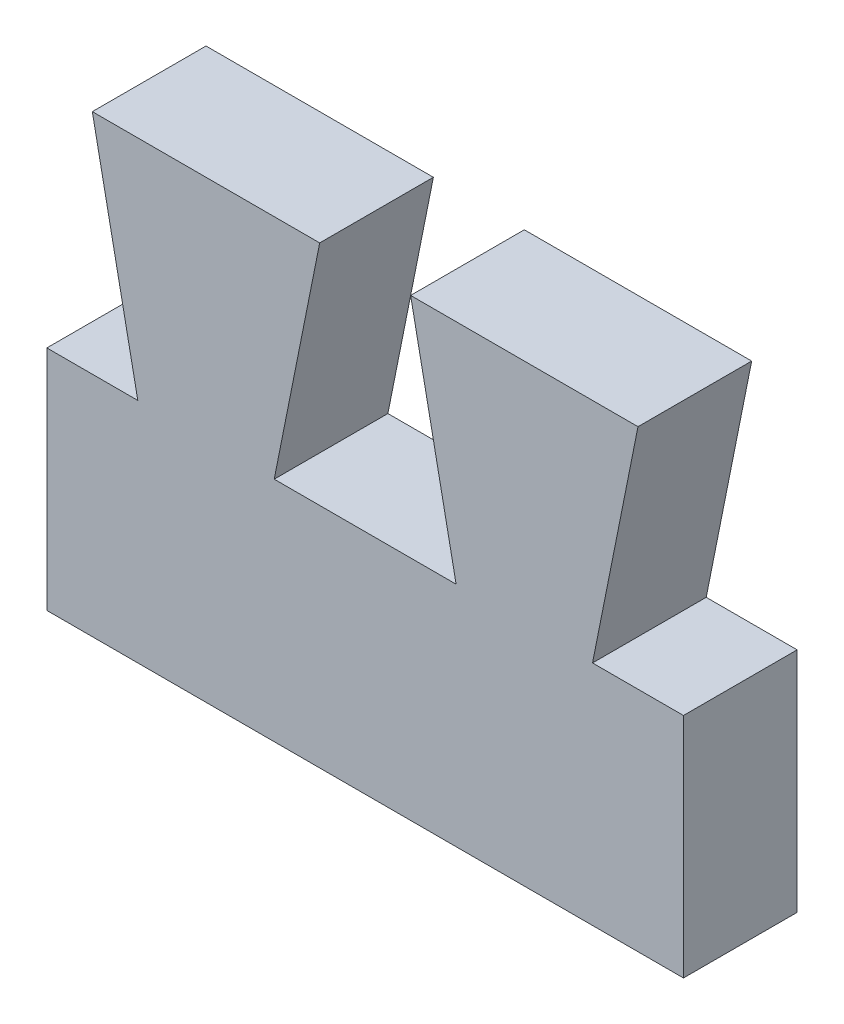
SolidWorks part; units mm, degrees
ref_plane "前视基准面" through (0, 0, 0) normal (0, 0, 1) x (1, 0, 0)
ref_plane "上视基准面" through (0, 0, 0) normal (0, 1, 0) x (1, 0, 0)
ref_plane "右视基准面" through (0, 0, 0) normal (1, 0, 0) x (0, 0, -1)
sketch "草图1" plane through (0, 0, 0) normal (0, 0, 1) x (1, 0, 0)
  line L0 (-12, 5) -> (-10, -5)
  line L1 (14, 5) -> (-14, 5)
  line L2 (14, 5) -> (14, -5)
  line L3 (14, -5) -> (-14, -5)
  line L4 (-14, 5) -> (-14, -5)
  line L5 (14, 5) -> (-14, -5) construction
  line L6 (14, -5) -> (-14, 5) construction
  line L7 (-4, -5) -> (-2, 5)
  line L8 (0, 0) -> (0, -5) construction
  line L9 (4, -5) -> (2, 5)
  line L10 (12, 5) -> (10, -5)
  point P0 (0, 0)
  dimension "D1" = 28
  dimension "D2" = 10
  dimension "D3" = 4
  dimension "D4" = 2
  dimension "D5" = 2
  dimension "D6" = 4
extrude "凸台-拉伸1" add sketch "草图1" along normal blind 5 contours L3 L7 L1 L0 | L10 L1 L9 L3
sketch "草图2" plane through (0, 0, 5) normal (0, 0, 1) x (1, 0, 0)
  line L1 (14, -15) -> (-14, -15)
  line L2 (14, -15) -> (14, -5)
  line L3 (14, -5) -> (-14, -5)
  line L4 (-14, -15) -> (-14, -5)
  line L5 (14, -15) -> (-14, -5) construction
  line L6 (14, -5) -> (-14, -15) construction
  point P0 (0, -10)
  dimension "D1" = 10
  dimension "D2" = 10
  dimension "D3" = 28
extrude "凸台-拉伸2" add sketch "草图2" against normal blind 5
